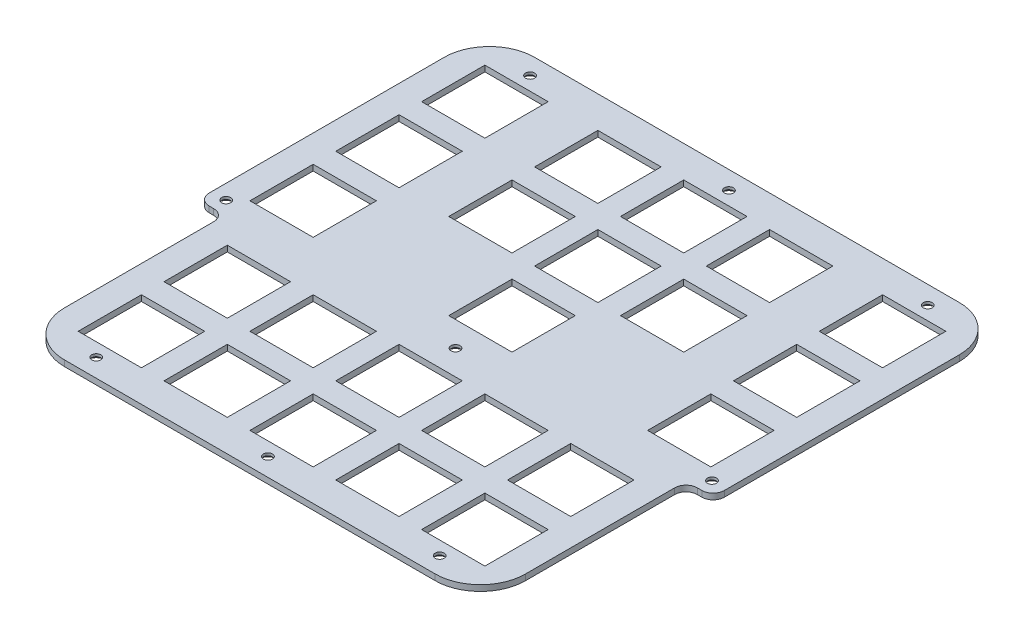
SolidWorks part; units mm, degrees
ref_plane "Front Plane" through (0, 0, 0) normal (0, 0, 1) x (1, 0, 0)
ref_plane "Top Plane" through (0, 0, 0) normal (0, 1, 0) x (1, 0, 0)
ref_plane "Right Plane" through (0, 0, 0) normal (1, 0, 0) x (0, 0, -1)
sketch "Sketch2" plane through (0, 0, 0) normal (0, 1, 0) x (1, 0, 0)
  line L0 (37, 18) -> (19, 18) construction
  line L1 (2, 2) -> (16, 2)
  line L2 (2, 2) -> (2, 16)
  line L3 (2, 16) -> (16, 16)
  line L4 (16, 2) -> (16, 16)
  line L5 (2, 2) -> (16, 16) construction
  line L6 (2, 16) -> (16, 2) construction
  line L7 (18, 0) -> (0, 0) construction
  line L8 (18, 0) -> (18, 18) construction
  line L9 (18, 18) -> (0, 18) construction
  line L10 (0, 0) -> (0, 18) construction
  line L11 (18, 0) -> (0, 18) construction
  line L12 (18, 18) -> (0, 0) construction
  line L13 (19, 0) -> (19, 18) construction
  line L14 (37, 0) -> (19, 0) construction
  line L15 (37, 0) -> (37, 18) construction
  line L16 (21, 2) -> (21, 16)
  line L17 (21, 2) -> (35, 2)
  line L18 (35, 2) -> (35, 16)
  line L19 (21, 16) -> (35, 16)
  line L20 (56, 18) -> (38, 18) construction
  line L21 (38, 0) -> (38, 18) construction
  line L22 (56, 0) -> (38, 0) construction
  line L23 (56, 0) -> (56, 18) construction
  line L24 (40, 2) -> (40, 16)
  line L25 (40, 2) -> (54, 2)
  line L26 (54, 2) -> (54, 16)
  line L27 (40, 16) -> (54, 16)
  line L28 (75, 18) -> (57, 18) construction
  line L29 (57, 0) -> (57, 18) construction
  line L30 (75, 0) -> (57, 0) construction
  line L31 (75, 0) -> (75, 18) construction
  line L32 (59, 2) -> (59, 16)
  line L33 (59, 2) -> (73, 2)
  line L34 (73, 2) -> (73, 16)
  line L35 (59, 16) -> (73, 16)
  line L36 (94, 18) -> (76, 18) construction
  line L37 (76, 0) -> (76, 18) construction
  line L38 (94, 0) -> (76, 0) construction
  line L39 (94, 0) -> (94, 18) construction
  line L40 (78, 2) -> (78, 16)
  line L41 (78, 2) -> (92, 2)
  line L42 (92, 2) -> (92, 16)
  line L43 (78, 16) -> (92, 16)
  line L44 (37, 37) -> (19, 37) construction
  line L45 (19, 19) -> (19, 37) construction
  line L46 (37, 19) -> (19, 19) construction
  line L47 (37, 19) -> (37, 37) construction
  line L48 (21, 21) -> (21, 35)
  line L49 (21, 21) -> (35, 21)
  line L50 (35, 21) -> (35, 35)
  line L51 (21, 35) -> (35, 35)
  line L52 (56, 37) -> (38, 37) construction
  line L53 (38, 19) -> (38, 37) construction
  line L54 (56, 19) -> (38, 19) construction
  line L55 (56, 19) -> (56, 37) construction
  line L56 (40, 21) -> (40, 35)
  line L57 (40, 21) -> (54, 21)
  line L58 (54, 21) -> (54, 35)
  line L59 (40, 35) -> (54, 35)
  line L60 (75, 37) -> (57, 37) construction
  line L61 (57, 19) -> (57, 37) construction
  line L62 (75, 19) -> (57, 19) construction
  line L63 (75, 19) -> (75, 37) construction
  line L64 (59, 21) -> (59, 35)
  line L65 (59, 21) -> (73, 21)
  line L66 (73, 21) -> (73, 35)
  line L67 (59, 35) -> (73, 35)
  line L68 (94, 37) -> (76, 37) construction
  line L69 (76, 19) -> (76, 37) construction
  line L70 (94, 19) -> (76, 19) construction
  line L71 (94, 19) -> (94, 37) construction
  line L72 (78, 21) -> (78, 35)
  line L73 (78, 21) -> (92, 21)
  line L74 (92, 21) -> (92, 35)
  line L75 (78, 35) -> (92, 35)
  line L76 (18, 37) -> (0, 37) construction
  line L77 (0, 19) -> (0, 37) construction
  line L78 (18, 19) -> (0, 19) construction
  line L79 (18, 19) -> (18, 37) construction
  line L80 (2, 21) -> (2, 35)
  line L81 (2, 21) -> (16, 21)
  line L82 (16, 21) -> (16, 35)
  line L83 (2, 35) -> (16, 35)
  line L84 (40, 84) -> (40, 98)
  line L85 (21, 84) -> (35, 84)
  line L86 (21, 84) -> (21, 98)
  line L87 (21, 98) -> (35, 98)
  line L88 (35, 84) -> (35, 98)
  line L89 (21, 84) -> (35, 98) construction
  line L90 (21, 98) -> (35, 84) construction
  line L91 (37, 82) -> (19, 82) construction
  line L92 (37, 82) -> (37, 100) construction
  line L93 (37, 100) -> (19, 100) construction
  line L94 (19, 82) -> (19, 100) construction
  line L95 (37, 82) -> (19, 100) construction
  line L96 (37, 100) -> (19, 82) construction
  line L97 (40, 84) -> (54, 84)
  line L98 (54, 84) -> (54, 98)
  line L99 (40, 98) -> (54, 98)
  line L100 (56, 100) -> (38, 100) construction
  line L101 (56, 82) -> (56, 100) construction
  line L102 (56, 82) -> (38, 82) construction
  line L103 (38, 82) -> (38, 100) construction
  line L104 (59, 84) -> (59, 98)
  line L105 (59, 84) -> (73, 84)
  line L106 (73, 84) -> (73, 98)
  line L107 (59, 98) -> (73, 98)
  line L108 (75, 100) -> (57, 100) construction
  line L109 (75, 82) -> (75, 100) construction
  line L110 (75, 82) -> (57, 82) construction
  line L111 (57, 82) -> (57, 100) construction
  line L112 (40, 65) -> (40, 79)
  line L113 (40, 65) -> (54, 65)
  line L114 (54, 65) -> (54, 79)
  line L115 (40, 79) -> (54, 79)
  line L116 (56, 81) -> (38, 81) construction
  line L117 (56, 63) -> (56, 81) construction
  line L118 (56, 63) -> (38, 63) construction
  line L119 (38, 63) -> (38, 81) construction
  line L120 (59, 65) -> (59, 79)
  line L121 (59, 65) -> (73, 65)
  line L122 (73, 65) -> (73, 79)
  line L123 (59, 79) -> (73, 79)
  line L124 (75, 81) -> (57, 81) construction
  line L125 (75, 63) -> (75, 81) construction
  line L126 (75, 63) -> (57, 63) construction
  line L127 (57, 63) -> (57, 81) construction
  line L128 (40, 46) -> (40, 60)
  line L129 (40, 46) -> (54, 46)
  line L130 (54, 46) -> (54, 60)
  line L131 (40, 60) -> (54, 60)
  line L132 (56, 62) -> (38, 62) construction
  line L133 (56, 44) -> (56, 62) construction
  line L134 (56, 44) -> (38, 44) construction
  line L135 (38, 44) -> (38, 62) construction
  line L136 (59, 46) -> (59, 60)
  line L137 (59, 46) -> (73, 46)
  line L138 (73, 46) -> (73, 60)
  line L139 (59, 60) -> (73, 60)
  line L140 (75, 62) -> (57, 62) construction
  line L141 (75, 44) -> (75, 62) construction
  line L142 (75, 44) -> (57, 44) construction
  line L143 (57, 44) -> (57, 62) construction
  line L144 (21, 65) -> (21, 79)
  line L145 (21, 65) -> (35, 65)
  line L146 (35, 65) -> (35, 79)
  line L147 (21, 79) -> (35, 79)
  line L148 (37, 81) -> (19, 81) construction
  line L149 (37, 63) -> (37, 81) construction
  line L150 (37, 63) -> (19, 63) construction
  line L151 (19, 63) -> (19, 81) construction
  line L152 (21, 46) -> (21, 60)
  line L153 (21, 46) -> (35, 46)
  line L154 (35, 46) -> (35, 60)
  line L155 (21, 60) -> (35, 60)
  line L156 (37, 62) -> (19, 62) construction
  line L157 (37, 44) -> (37, 62) construction
  line L158 (37, 44) -> (19, 44) construction
  line L159 (19, 44) -> (19, 62) construction
  line L160 (18, 18) -> (37, 18) construction
  line L161 (18, 18) -> (18, 37) construction
  line L162 (21, 84) -> (40, 84) construction
  line L163 (21, 84) -> (21, 65) construction
  line L165 (10, 46) -> (-4, 46)
  line L166 (10, 46) -> (10, 60)
  line L167 (10, 60) -> (-4, 60)
  line L168 (-4, 46) -> (-4, 60)
  line L169 (10, 46) -> (-4, 60) construction
  line L170 (10, 60) -> (-4, 46) construction
  line L171 (12, 44) -> (-6, 44) construction
  line L172 (12, 44) -> (12, 62) construction
  line L173 (12, 62) -> (-6, 62) construction
  line L174 (-6, 44) -> (-6, 62) construction
  line L175 (12, 44) -> (-6, 62) construction
  line L176 (12, 62) -> (-6, 44) construction
  line L181 (100, 82) -> (100, 100) construction
  line L182 (82, 82) -> (100, 82) construction
  line L183 (82, 82) -> (82, 100) construction
  line L188 (82, 100) -> (100, 100) construction
  line L189 (100, 63) -> (100, 81) construction
  line L190 (82, 63) -> (100, 63) construction
  line L191 (82, 63) -> (82, 81) construction
  line L196 (82, 81) -> (100, 81) construction
  line L197 (82, 62) -> (100, 44) construction
  line L198 (82, 44) -> (100, 62) construction
  line L199 (100, 44) -> (100, 62) construction
  line L200 (10, 65) -> (10, 79)
  line L201 (10, 65) -> (-4, 65)
  line L202 (-4, 65) -> (-4, 79)
  line L203 (10, 79) -> (-4, 79)
  line L204 (12, 81) -> (-6, 81) construction
  line L205 (12, 63) -> (12, 81) construction
  line L206 (12, 63) -> (-6, 63) construction
  line L207 (-6, 63) -> (-6, 81) construction
  line L208 (10, 84) -> (10, 98)
  line L209 (10, 84) -> (-4, 84)
  line L210 (-4, 84) -> (-4, 98)
  line L211 (10, 98) -> (-4, 98)
  line L212 (12, 100) -> (-6, 100) construction
  line L213 (12, 82) -> (12, 100) construction
  line L214 (12, 82) -> (-6, 82) construction
  line L215 (-6, 82) -> (-6, 100) construction
  line L216 (82, 62) -> (100, 62) construction
  line L217 (82, 44) -> (82, 62) construction
  line L218 (82, 44) -> (100, 44) construction
  line L219 (84, 60) -> (98, 46) construction
  line L220 (84, 46) -> (98, 60) construction
  line L221 (84, 98) -> (98, 98)
  line L222 (98, 84) -> (98, 98)
  line L223 (84, 84) -> (98, 84)
  line L224 (84, 84) -> (84, 98)
  line L225 (84, 79) -> (98, 79)
  line L226 (98, 65) -> (98, 79)
  line L227 (84, 65) -> (98, 65)
  line L228 (84, 65) -> (84, 79)
  line L229 (98, 46) -> (98, 60)
  line L230 (84, 60) -> (98, 60)
  line L231 (84, 46) -> (84, 60)
  line L232 (84, 46) -> (98, 46)
  line L233 (10, 46) -> (10, 65) construction
  line L234 (-4, 5) -> (-4, 38)
  line L240 (-10, 95) -> (-10, 43)
  line L243 (-6.5, 40.5) -> (-7.5, 40.5)
  line L244 (104, 95) -> (104, 43)
  line L245 (100.5, 40.5) -> (101.5, 40.5)
  line L246 (98, 5) -> (98, 38)
  line L247 (0, 105) -> (94, 105)
  line L248 (6, -5) -> (88, -5)
  arc A0 (6, -5) -> (-4, 5) centre (6, 5) cw
  arc A1 (-10, 43) -> (-7.5, 40.5) centre (-7.5, 43) ccw
  arc A2 (-4, 38) -> (-6.5, 40.5) centre (-6.5, 38) ccw
  arc A3 (-10, 95) -> (0, 105) centre (0, 95) cw
  arc A4 (104, 95) -> (94, 105) centre (94, 95) ccw
  arc A5 (104, 43) -> (101.5, 40.5) centre (101.5, 43) cw
  arc A6 (98, 38) -> (100.5, 40.5) centre (100.5, 38) cw
  arc A7 (88, -5) -> (98, 5) centre (88, 5) ccw
  point P0 (9, 9)
  point P5 (9, 9)
  point P10 (28, 91)
  point P88 (28, 91)
  point P93 (3, 53)
  point P168 (3, 53)
  point P199 (91, 53)
  point P217 (47, 44)
  point P234 (-10, 105)
  dimension "D23" = 10
  dimension "D26" = 2.5
  dimension "D27" = 10
  dimension "D22" = 94
  dimension "D1" = 14
  dimension "D2" = 18
  dimension "D5" = 14
  dimension "D6" = 18
  dimension "D7" = 3
  dimension "D9" = 7
  dimension "D10" = 19
  dimension "D11" = 19
  dimension "D12" = 90
  dimension "D13" = 19
  dimension "D14" = 19
  dimension "D15" = 90
  dimension "D16" = 14
  dimension "D17" = 18
  dimension "D18" = 7
  dimension "D21" = 19
  dimension "D24" = 82
  dimension "D25" = 4
  dimension "D3" = 5
  dimension "D4" = 2
  dimension "D8" = 3
  dimension "D19" = 1
  dimension "D20" = 3
extrude "Boss-Extrude1" add sketch "Sketch2" along normal blind 1.3
sketch "Sketch7" plane through (0, 0, 0) normal (0, -1, 0) x (1, 0, 0)
  line L0 (56, 0) -> (38, 0) construction
  line L1 (56, -100) -> (38, -100) construction
  line L2 (82, -100) -> (100, -100) construction
  line L3 (12, -100) -> (-6, -100) construction
  line L4 (18, 0) -> (0, 0) construction
  line L5 (94, 0) -> (76, 0) construction
  line L6 (100, -44) -> (101.5, -43) construction
  line L7 (-6, -44) -> (-7.5, -43) construction
  line L8 (47, -44) -> (47, -37) construction
  line L9 (56, -44) -> (38, -44) construction
  line L10 (56, -37) -> (38, -37) construction
  line L13 (6, 5) -> (88, 5) construction
  point P2 (0, 0)
  point P3 (47, -40.5)
  point P4 (0, 0)
  point P5 (47, 1)
  point P9 (47, -101)
  point P12 (91, -100)
  point P13 (91, -101)
  point P16 (3, -100)
  point P17 (3, -101)
  point P20 (9, 0)
  point P21 (9, 1)
  point P24 (85, 0)
  point P25 (85, 1)
  point P31 (100.75, -43.5)
  point P32 (-6.75, -43.5)
  point P44 (0, 0)
  dimension "D1" = 1
  dimension "D2" = 1
  dimension "D3" = 1
hole_wizard "CSK for M2 Cross Countersunk Head Screw4" positions "3DSketch7" profile "Sketch10" countersink size "M2" standard "AS"
sketch3d "3DSketch7"
  point P0 (-6.75, 0, -43.5)
  point P3 (9, 0, 1)
  point P6 (47, 0, 1)
  point P9 (85, 0, 1)
  point P12 (100.75, 0, -43.5)
  point P15 (91, 0, -101)
  point P18 (47, 0, -101)
  point P21 (3, 0, -101)
  point P24 (47, 0, -40.5)
sketch "Sketch10" plane through (-6.75, 0, -43.5) normal (1, 0, 0) x (0, 0, -1)
  line L0 (0, 0) -> (0, 1.3)
  line L1 (0, 1.3) -> (1, 1.3)
  line L2 (1, 1.3) -> (1, 0.7243)
  line L3 (1, 0.7243) -> (1.75, 0)
  line L5 (1.75, 0) -> (0, 0)
  line L6 (-1, 0.7243) -> (-1.75, 0) construction
  line L11 (0, -6.35) -> (0, 107.95) construction
  dimension "Thru Hole Dia." = 2
  dimension "Thru Hole Depth" = 1.3
  dimension "Near C'Sink Dia." = 3.5
  dimension "Near C'Sink Angle" = 92
